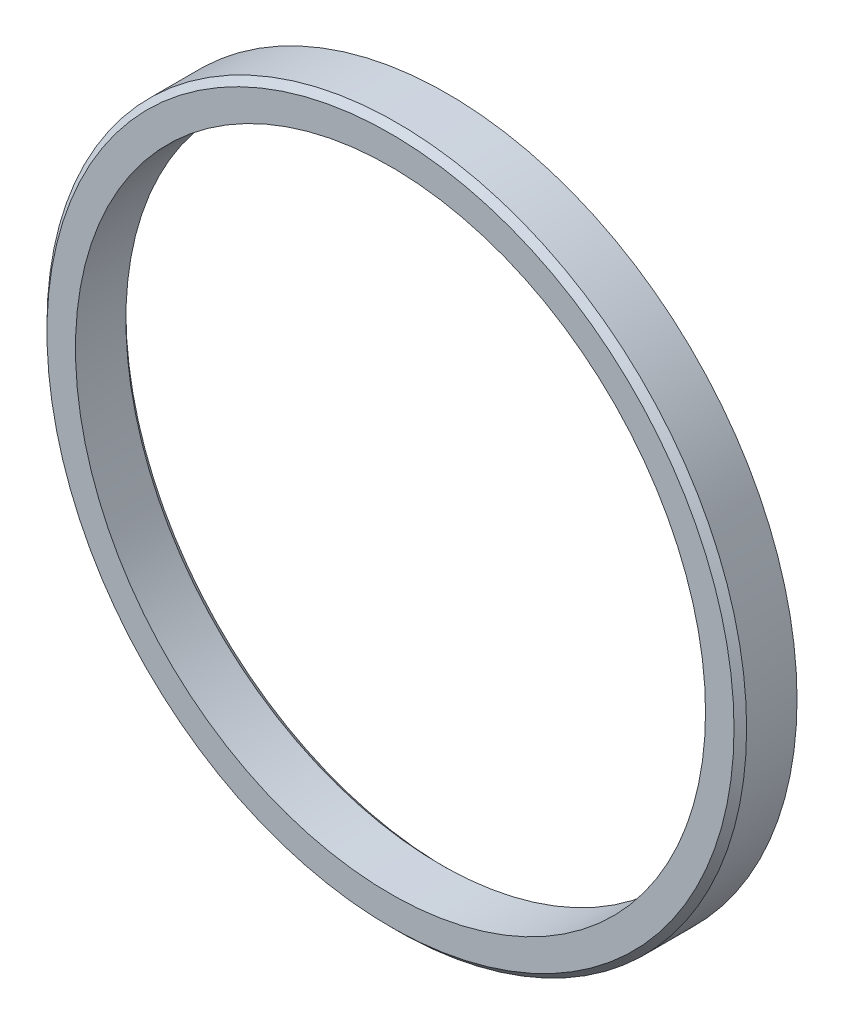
SolidWorks part; units mm, degrees
ref_plane "Front Plane" through (0, 0, 0) normal (0, 0, 1) x (1, 0, 0)
ref_plane "Top Plane" through (0, 0, 0) normal (0, 1, 0) x (1, 0, 0)
ref_plane "Right Plane" through (0, 0, 0) normal (1, 0, 0) x (0, 0, -1)
sketch "Sketch1" plane through (0, 0, 0) normal (1, 0, 0) x (0, 0, -1)
  line L0 (-66.6227, 0) -> (66.6227, 0) construction
  line L1 (-8, 100) -> (8, 100)
  line L2 (8, 100) -> (10, 102)
  line L3 (10, 102) -> (10, 111.05)
  line L4 (10, 111.05) -> (-6, 111.05)
  line L5 (-6, 111.05) -> (-8, 109.05)
  line L6 (-8, 109.05) -> (-8, 100)
  line L7 (0, -152.3213) -> (0, 152.3213) construction
  point P3 (0, 100)
  point P4 (0, 0)
  point P13 (0, 0)
  dimension "D1" = 45
  dimension "D2" = 45
  dimension "D3" = 2
  dimension "D4" = 2
  dimension "D5" = 200
  dimension "D6" = 222.1
  dimension "D7" = 18
revolve "Revolve1" add sketch "Sketch1" angle 360 about L0
